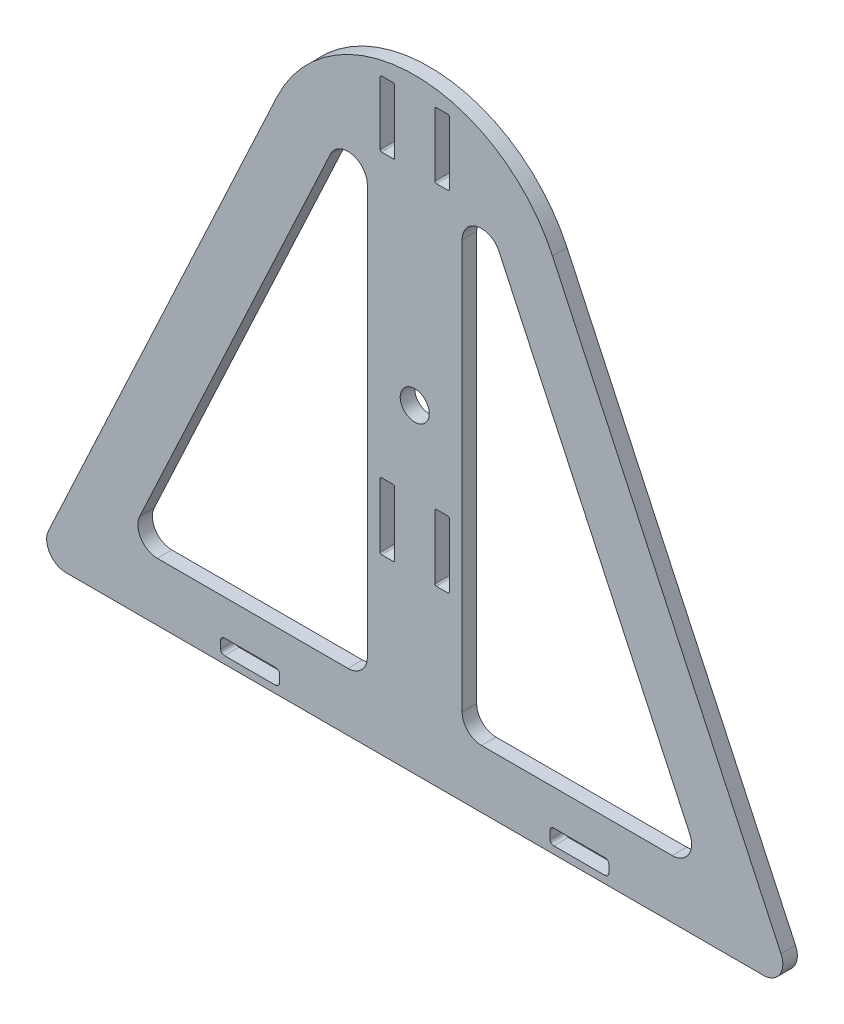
SolidWorks part; units mm, degrees
ref_plane "Front Plane" through (0, 0, 0) normal (0, 0, 1) x (1, 0, 0)
ref_plane "Top Plane" through (0, 0, 0) normal (0, 1, 0) x (1, 0, 0)
ref_plane "Right Plane" through (0, 0, 0) normal (1, 0, 0) x (0, 0, -1)
sketch "Sketch1" plane through (0, 0, 0) normal (0, 0, 1) x (1, 0, 0)
  line L0 (-120.0551, 6.4936) -> (-45.1593, 167.1081)
  line L1 (0, 279.3295) -> (0, -2.54) construction
  line L2 (120.0551, 6.4936) -> (45.1593, 167.1081)
  line L3 (-10.8382, 190.1825) -> (-7.0917, 190.1825)
  line L4 (-114.3, -2.54) -> (-30.2362, -2.54)
  line L5 (-30.2362, -2.54) -> (30.2362, -2.54)
  line L6 (6.5837, 169.1005) -> (6.5837, 189.6745)
  line L7 (10.8382, 168.5925) -> (7.0917, 168.5925)
  line L8 (11.3462, 189.6745) -> (11.3462, 169.1005)
  line L9 (10.8382, 190.1825) -> (7.0917, 190.1825)
  line L23 (-11.3462, 189.6745) -> (-11.3462, 169.1005)
  line L25 (-10.8382, 168.5925) -> (-7.0917, 168.5925)
  line L26 (-6.5837, 169.1005) -> (-6.5837, 189.6745)
  line L35 (7.0917, 76.1365) -> (10.8382, 76.1365)
  line L36 (6.5837, 54.8005) -> (6.5837, 75.6285)
  line L37 (10.8382, 54.2925) -> (7.0917, 54.2925)
  line L38 (11.3462, 75.6285) -> (11.3462, 54.8005)
  line L43 (63.627, 3.6195) -> (63.627, 1.143)
  line L44 (45.593, 4.8895) -> (62.357, 4.8895)
  line L45 (44.323, 1.143) -> (44.323, 3.6195)
  line L46 (62.357, -0.127) -> (45.593, -0.127)
  line L47 (-53.975, 6.807) -> (-53.975, -6.8456) construction
  line L51 (-62.357, -0.127) -> (-45.593, -0.127)
  line L52 (-44.323, 1.143) -> (-44.323, 3.6195)
  line L53 (-45.593, 4.8895) -> (-62.357, 4.8895)
  line L54 (-63.627, 3.6195) -> (-63.627, 1.143)
  line L56 (-43.5203, 0) -> (43.5203, 0) construction
  line L62 (114.3, -2.54) -> (30.2362, -2.54)
  line L309 (-11.3462, 75.6285) -> (-11.3462, 54.8005)
  line L310 (-11.3462, 168.9328) -> (-11.3462, 75.5422) construction
  line L311 (-11.3462, 54.6328) -> (-11.3462, 30.1625) construction
  line L312 (-10.8382, 54.2925) -> (-7.0917, 54.2925)
  line L313 (-6.5837, 54.6328) -> (-6.5837, 30.1625) construction
  line L314 (-6.5837, 54.8005) -> (-6.5837, 75.6285)
  line L315 (-6.5837, 168.9328) -> (-6.5837, 75.5422) construction
  line L316 (-7.0917, 76.1365) -> (-10.8382, 76.1365)
  arc A0 (-45.1593, 167.1081) -> (45.1593, 167.1081) centre (0, 146.05) cw
  arc A1 (-6.5837, 189.6745) -> (-7.0917, 190.1825) centre (-7.0917, 189.6745) ccw
  arc A2 (-114.3, -2.54) -> (-120.0551, 6.4936) centre (-114.3, 3.81) cw
  arc A3 (-63.627, 1.143) -> (-62.357, -0.127) centre (-62.357, 1.143) ccw
  arc A4 (-63.627, 3.6195) -> (-62.357, 4.8895) centre (-62.357, 3.6195) cw
  arc A5 (-44.323, 3.6195) -> (-45.593, 4.8895) centre (-45.593, 3.6195) ccw
  arc A6 (-45.593, -0.127) -> (-44.323, 1.143) centre (-45.593, 1.143) ccw
  arc A7 (114.3, -2.54) -> (120.0551, 6.4936) centre (114.3, 3.81) ccw
  arc A8 (-11.3462, 189.6745) -> (-10.8382, 190.1825) centre (-10.8382, 189.6745) cw
  arc A9 (-11.3462, 75.6285) -> (-10.8382, 76.1365) centre (-10.8382, 75.6285) cw
  arc A10 (-10.8382, 54.2925) -> (-11.3462, 54.8005) centre (-10.8382, 54.8005) cw
  arc A11 (-6.5837, 54.8005) -> (-7.0917, 54.2925) centre (-7.0917, 54.8005) cw
  arc A12 (-6.5837, 75.6285) -> (-7.0917, 76.1365) centre (-7.0917, 75.6285) ccw
  arc A13 (6.5837, 75.6285) -> (7.0917, 76.1365) centre (7.0917, 75.6285) cw
  arc A14 (6.5837, 54.8005) -> (7.0917, 54.2925) centre (7.0917, 54.8005) ccw
  arc A15 (10.8382, 54.2925) -> (11.3462, 54.8005) centre (10.8382, 54.8005) ccw
  arc A16 (11.3462, 75.6285) -> (10.8382, 76.1365) centre (10.8382, 75.6285) ccw
  arc A17 (44.323, 3.6195) -> (45.593, 4.8895) centre (45.593, 3.6195) cw
  arc A18 (44.323, 1.143) -> (45.593, -0.127) centre (45.593, 1.143) ccw
  arc A19 (62.357, -0.127) -> (63.627, 1.143) centre (62.357, 1.143) ccw
  arc A20 (63.627, 3.6195) -> (62.357, 4.8895) centre (62.357, 3.6195) ccw
  arc A21 (7.0917, 168.5925) -> (6.5837, 169.1005) centre (7.0917, 169.1005) cw
  arc A22 (10.8382, 168.5925) -> (11.3462, 169.1005) centre (10.8382, 169.1005) ccw
  arc A23 (-10.8382, 168.5925) -> (-11.3462, 169.1005) centre (-10.8382, 169.1005) cw
  arc A24 (-7.0917, 168.5925) -> (-6.5837, 169.1005) centre (-7.0917, 169.1005) ccw
  arc A25 (11.3462, 189.6745) -> (10.8382, 190.1825) centre (10.8382, 189.6745) ccw
  arc A26 (6.5837, 189.6745) -> (7.0917, 190.1825) centre (7.0917, 189.6745) cw
  point P60 (-11.3462, 76.1365)
  point P63 (-11.3462, 54.2925)
  point P66 (-6.5837, 54.2925)
  point P69 (-6.5837, 76.1365)
  point P87 (44.323, 4.8895)
  point P90 (44.323, -0.127)
  point P93 (63.627, -0.127)
  point P96 (63.627, 4.8895)
  point P99 (-11.3462, 168.5925)
  point P102 (-6.5837, 168.5925)
  dimension "D1" = 25
  dimension "D5" = 146.05
  dimension "D7" = 1.27
  dimension "D2" = 0.508
  dimension "D3" = 0.508
  dimension "D6" = 2.54
  dimension "D4" = 2.413
  dimension "D9" = 7.4295
  dimension "D10" = 19.304
  dimension "D11" = 53.975
extrude "Extrude1" add sketch "Sketch1" along normal blind 4.7625
sketch "Sketch2" plane through (0, 0, 4.7625) normal (0, 0, 1) x (1, 0, 0)
  line L0 (-114.3, -2.54) -> (114.3, -2.54) construction
  circle A0 centre (0, 102.108) radius 4.7625
  dimension "D1" = 9.525
  dimension "D2" = 104.648
extrude "Cut-Extrude1" cut sketch "Sketch2" against normal through all
sketch "Sketch3" plane through (0, 0, 4.7625) normal (0, 0, 1) x (1, 0, 0)
  line L0 (84.3975, 16.51) -> (21.8872, 16.51)
  line L1 (15.5372, 22.86) -> (15.5372, 156.9137)
  line L2 (27.6423, 159.5974) -> (90.1525, 25.5436)
  line L3 (0, -17.222) -> (0, 282.6472) construction
  line L4 (-27.6423, 159.5974) -> (-90.1525, 25.5436)
  line L5 (-15.5372, 22.86) -> (-15.5372, 156.9137)
  line L6 (-84.3975, 16.51) -> (-21.8872, 16.51)
  arc A0 (-15.5372, 156.9137) -> (-27.6423, 159.5974) centre (-21.8872, 156.9137) ccw
  arc A1 (-21.8872, 16.51) -> (-15.5372, 22.86) centre (-21.8872, 22.86) ccw
  arc A2 (-84.3975, 16.51) -> (-90.1525, 25.5436) centre (-84.3975, 22.86) cw
  arc A3 (21.8872, 16.51) -> (15.5372, 22.86) centre (21.8872, 22.86) cw
  arc A4 (84.3975, 16.51) -> (90.1525, 25.5436) centre (84.3975, 22.86) ccw
  arc A5 (27.6423, 159.5974) -> (15.5372, 156.9137) centre (21.8872, 156.9137) ccw
  point P11 (-15.5372, 185.5567)
  point P14 (-15.5372, 16.51)
  point P17 (-94.365, 16.51)
  point P20 (15.5372, 16.51)
  point P23 (94.365, 16.51)
  point P26 (15.5372, 185.5567)
  dimension "D1" = 6.35
extrude "Cut-Extrude2" cut sketch "Sketch3" against normal through all
